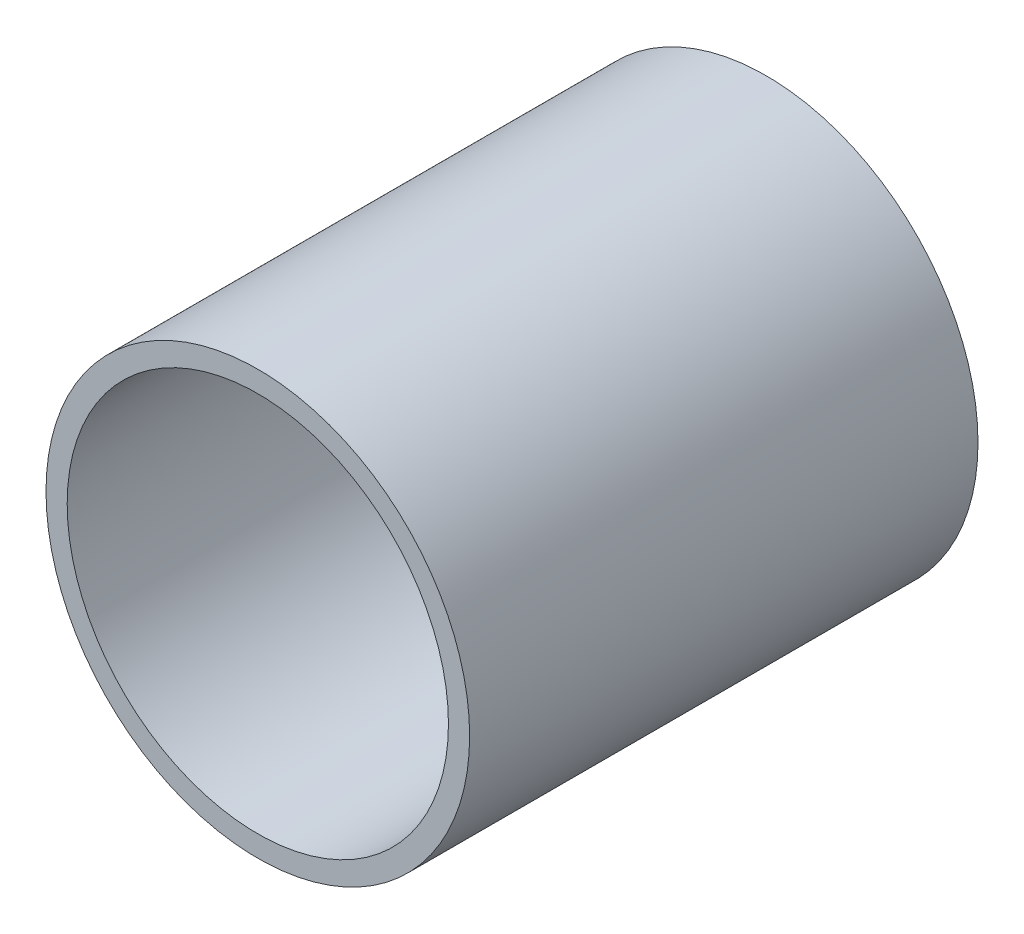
SolidWorks part; units mm, degrees
ref_plane "Face" through (0, 0, 0) normal (0, 0, 1) x (1, 0, 0)
ref_plane "Dessus" through (0, 0, 0) normal (0, 1, 0) x (1, 0, 0)
ref_plane "Droite" through (0, 0, 0) normal (1, 0, 0) x (0, 0, -1)
sketch "Esquisse1" plane through (0, 0, 0) normal (0, 0, 1) x (1, 0, 0)
  circle A0 centre (0, 0) radius 50
  circle A1 centre (0, 0) radius 45
  dimension "D1" = 100
  dimension "D2" = 5
extrude "Extrusion1" add sketch "Esquisse1" along normal blind 120
